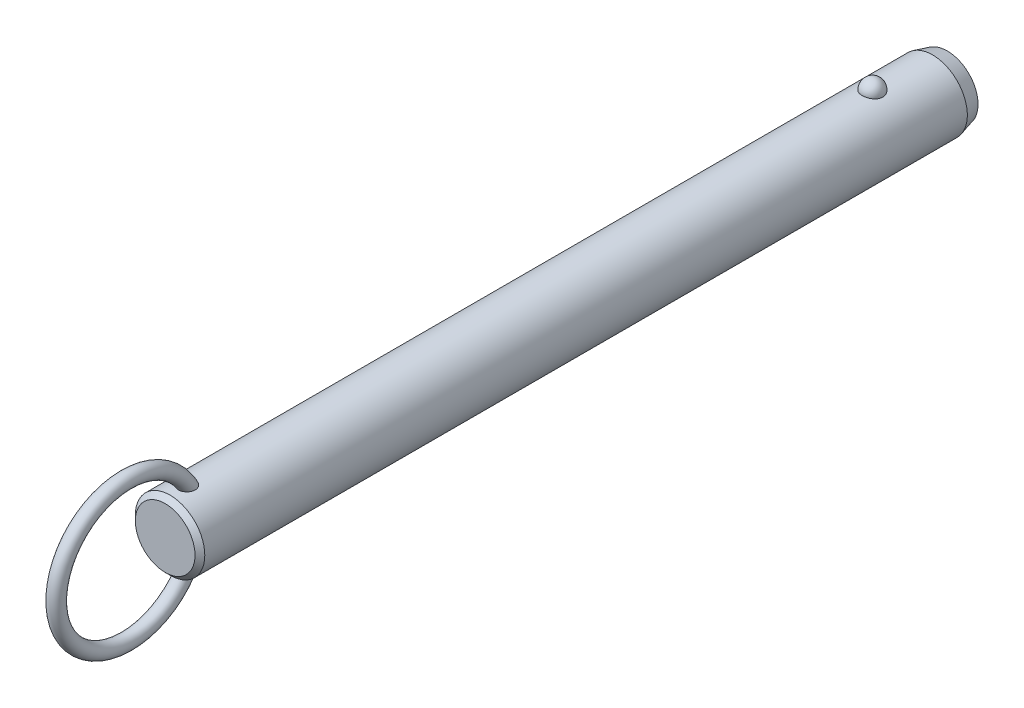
SolidWorks part; units mm, degrees
ref_plane "Front Plane" through (0, 0, 0) normal (0, 0, 1) x (1, 0, 0)
ref_plane "Top Plane" through (0, 0, 0) normal (0, 1, 0) x (1, 0, 0)
ref_plane "Right Plane" through (0, 0, 0) normal (1, 0, 0) x (0, 0, -1)
sketch "Sketch2" plane through (0, 0, 0) normal (0, 0, 1) x (1, 0, 0)
  circle A0 centre (0, 0) radius 7.1
  point P3 (0, 7.1)
  dimension "D1" = 14.2
extrude "Boss-Extrude1" add sketch "Sketch2" along normal blind 134.6
sketch "Sketch3" plane through (0, 0, 0) normal (0, 0, -1) x (-1, 0, 0)
  circle A0 centre (0, 0) radius 7.1
  dimension "D1" = 14.2
extrude "Boss-Extrude2" add sketch "Sketch3" along normal blind 17.4
chamfer "Chamfer1" distance 3 angle 15 1 edges at (-7.1, 0, -17.4)
sketch "Sketch12" plane through (0, 0, 0) normal (1, 0, 0) x (0, 0, -1)
  line L0 (-134.6, 7.1) -> (-134.6, -7.1) construction
  point P0 (-134.6, 0)
sketch "Sketch13" plane through (0, 0, 0) normal (1, 0, 0) x (0, 0, -1)
  circle A0 centre (-150.45, 0) radius 15.85
  point P2 (-134.6, 0)
  dimension "D1" = 31.7
sketch "Sketch14" plane through (0, 0, 0) normal (0, 1, 0) x (1, 0, 0)
  circle A0 centre (0, -136.1) radius 1.5
  point P2 (0, -134.6)
  dimension "D1" = 3
sweep "Sweep1" add profiles "Sketch14" path "Sketch13"
sketch "Sketch15" plane through (0, 0, 134.6) normal (0, 0, 1) x (1, 0, 0)
  circle A0 centre (0, 0) radius 7.1
  dimension "D1" = 14.2
extrude "Boss-Extrude3" add sketch "Sketch15" along normal blind 7.92
chamfer "Chamfer2" distance 1 angle 45 1 edges at (7.1, 0, 142.52)
sketch "Sketch18" plane through (0, 0, 0) normal (1, 0, 0) x (0, 0, -1)
  line L0 (14.4, 7.1) -> (-136.2792, 7.1) construction
  line L1 (2.1, 9.2) -> (2.1, 5)
  line L2 (-136.2792, -7.1) -> (14.4, -7.1) construction
  arc A0 (2.1, 9.2) -> (2.1, 5) centre (2.1, 7.1) ccw
  point P4 (0, 7.1)
  dimension "D1" = 16.3
revolve "Revolve1" add sketch "Sketch18" angle 360 about L1
